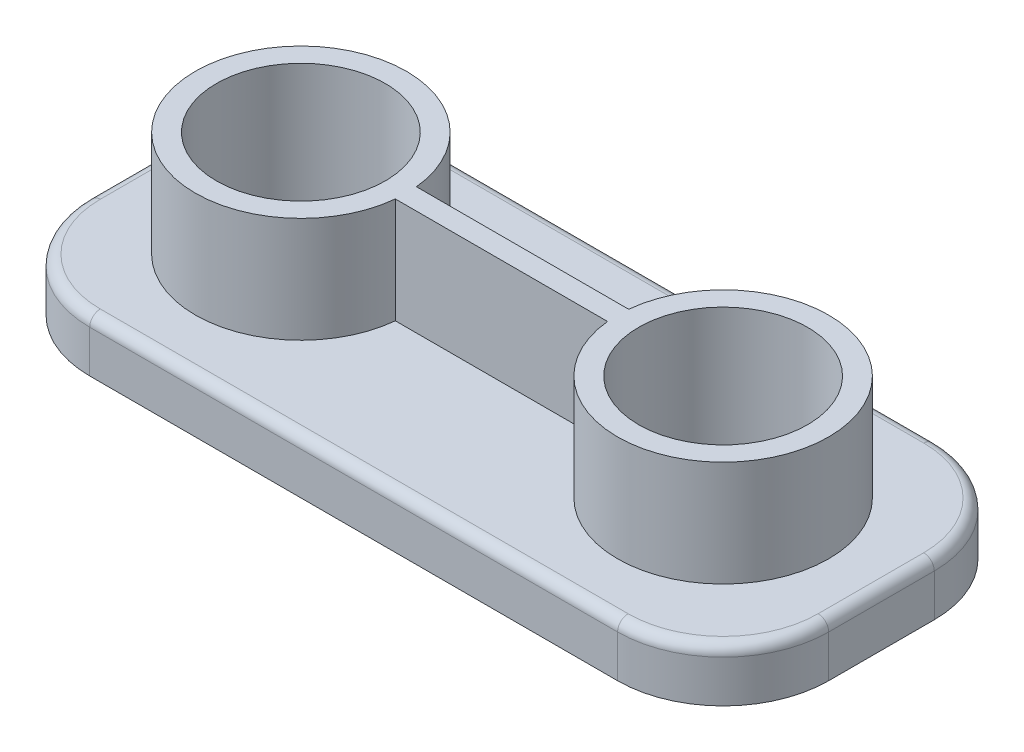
SolidWorks part; units mm, degrees
ref_plane "Front Plane" through (0, 0, 0) normal (0, 0, 1) x (1, 0, 0)
ref_plane "Top Plane" through (0, 0, 0) normal (0, 1, 0) x (1, 0, 0)
ref_plane "Right Plane" through (0, 0, 0) normal (1, 0, 0) x (0, 0, -1)
sketch "Sketch1" plane through (0, 0, 0) normal (0, 1, 0) x (1, 0, 0)
  line L0 (-88.9, -38.1) -> (88.9, 38.1) construction
  line L1 (-63.5, -38.1) -> (63.5, -38.1)
  line L2 (-88.9, -12.7) -> (-88.9, 12.7)
  line L3 (-63.5, 38.1) -> (63.5, 38.1)
  line L4 (88.9, -12.7) -> (88.9, 12.7)
  arc A0 (-88.9, 12.7) -> (-63.5, 38.1) centre (-63.5, 12.7) cw
  arc A1 (63.5, 38.1) -> (88.9, 12.7) centre (63.5, 12.7) cw
  arc A2 (63.5, -38.1) -> (88.9, -12.7) centre (63.5, -12.7) ccw
  arc A3 (-63.5, -38.1) -> (-88.9, -12.7) centre (-63.5, -12.7) cw
  point P7 (-88.9, 38.1)
  point P13 (88.9, -38.1)
  dimension "D3" = 25.4
  dimension "D1" = 177.8
  dimension "D2" = 76.2
extrude "Extrude1" add sketch "Sketch1" against normal blind 12.7
sketch "Sketch2" plane through (0, 0, 0) normal (0, 1, 0) x (-1, 0, 0)
  circle A0 centre (50.8, 0) radius 25.4
  circle A1 centre (-50.8, 0) radius 25.4
  dimension "D1" = 50.8
  dimension "D2" = 50.8
  dimension "D3" = 50.8
extrude "Extrude2" add sketch "Sketch2" along normal blind 25.4
fillet "Fillet1" radius 2.54 8 edges at (-81.4605, 0, 30.6605) (-88.9, 0, 0) (-81.4605, 0, -30.6605) (0, 0, -38.1) (81.4605, 0, -30.6605) (88.9, 0, 0) (81.4605, 0, 30.6605) (0, 0, 38.1)
sketch "Sketch3" plane through (0, 25.4, 0) normal (0, 1, 0) x (-1, 0, 0)
  circle A2 centre (-50.8, 0) radius 20.32
  circle A3 centre (-50.8, 0) radius 20.32
  circle A5 centre (50.8, 0) radius 20.32
  circle A6 centre (50.8, 0) radius 20.32
  dimension "D1" = 5.08
  dimension "D2" = 5.08
extrude "Cut-Extrude1" cut sketch "Sketch3" against normal through all
sketch "Sketch4" plane through (0, 25.4, 0) normal (0, 1, 0) x (-1, 0, 0)
  line L0 (-25.4, 0) -> (25.4, 0)
  circle A0 centre (-50.8, 0) radius 25.4 construction
  circle A1 centre (50.8, 0) radius 25.4 construction
rib "Rib1" sketch "Sketch4" sketch "Sketch4" thickness 5.08 extrusion direction normal to sketch draft on no parameters "D1"=5.08
